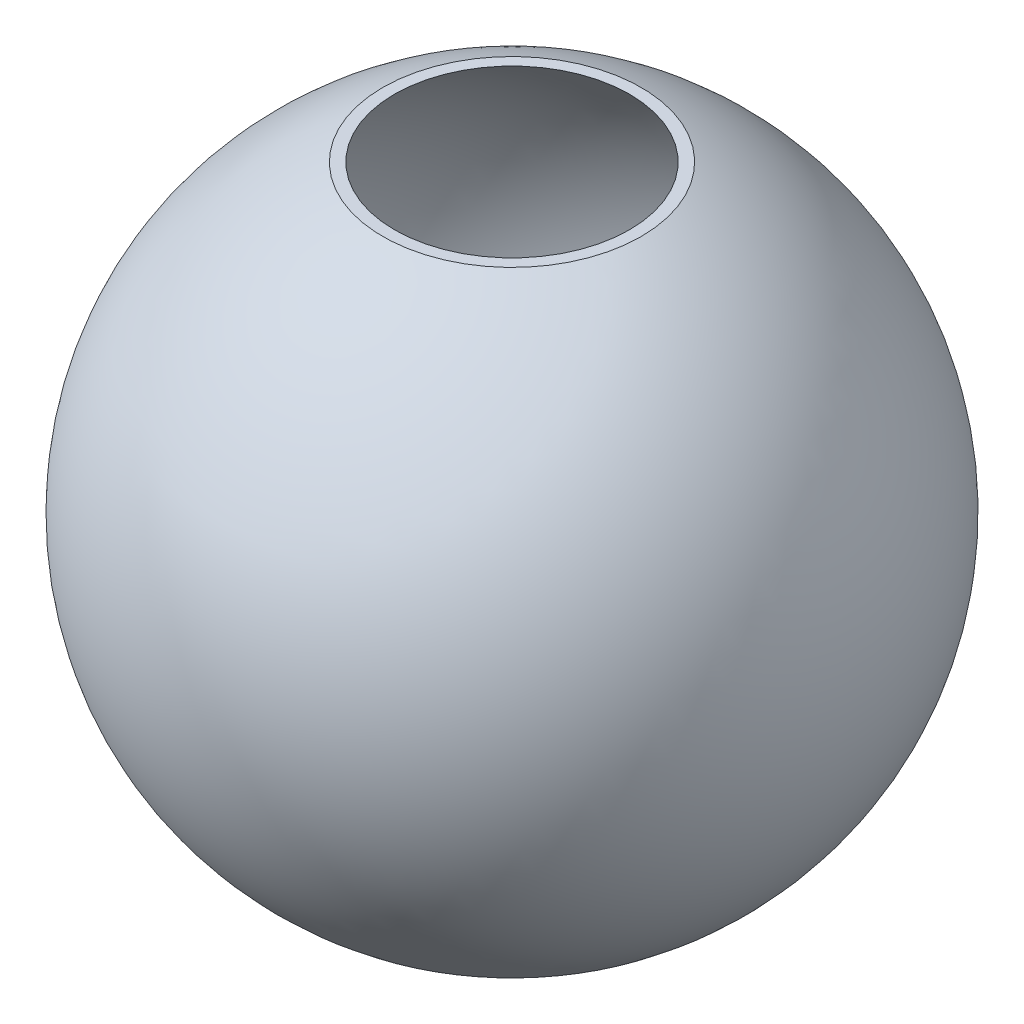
SolidWorks part; units mm, degrees
ref_plane "Płaszczyzna przednia" through (0, 0, 0) normal (0, 0, 1) x (1, 0, 0)
ref_plane "Płaszczyzna górna" through (0, 0, 0) normal (0, 1, 0) x (1, 0, 0)
ref_plane "Płaszczyzna prawa" through (0, 0, 0) normal (1, 0, 0) x (0, 0, -1)
sketch "Szkic1" plane through (0, 0, 0) normal (0, 0, 1) x (1, 0, 0)
  line L1 (0, -75) -> (0, -74)
  line L2 (29.3939, 69) -> (0, 69) construction
  line L3 (0, 69) -> (0, 0) construction
  line L4 (26.7395, 69) -> (29.3939, 69)
  arc A0 (0, -75) -> (29.3939, 69) centre (0, 0) ccw
  arc A1 (0, -74) -> (26.7395, 69) centre (0, 0) ccw
  dimension "D1" = 1
  dimension "D2" = 75
  dimension "D3" = 144
revolve "Obrót1" add sketch "Szkic1" angle 360 about L3
sketch "Szkic2" plane through (0, 0, 0) normal (0, 1, 0) x (1, 0, 0)
  circle A0 centre (0, 0) radius 13
ref_plane "Płaszczyzna1" through (0, 110, 0) normal (0, 1, 0) x (1, 0, 0)
